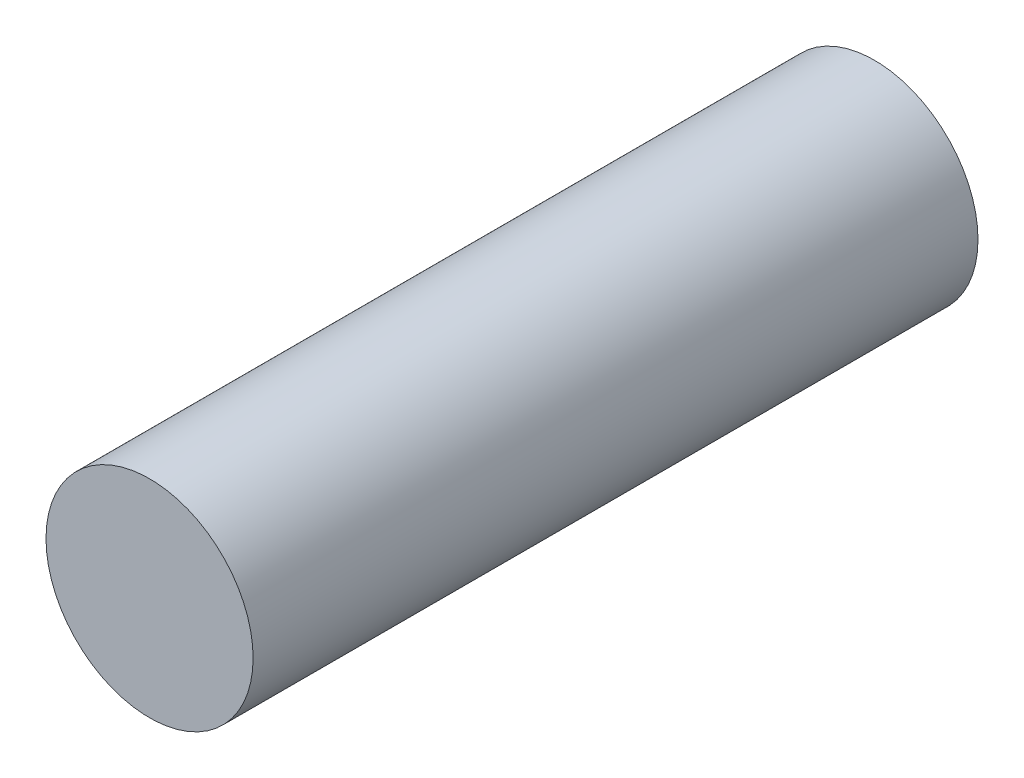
SolidWorks part; units mm, degrees
ref_plane "Ebene vorne" through (0, 0, 0) normal (0, 0, 1) x (1, 0, 0)
ref_plane "Ebene oben" through (0, 0, 0) normal (0, 1, 0) x (1, 0, 0)
ref_plane "Ebene rechts" through (0, 0, 0) normal (1, 0, 0) x (0, 0, -1)
sketch "Skizze1" plane through (0, 0, 0) normal (0, 0, 1) x (1, 0, 0)
  circle A0 centre (0, 20) radius 10
  dimension "D1" = 20
  dimension "D2" = 20
extrude "Linear austragen1" add sketch "Skizze1" along normal blind 70
